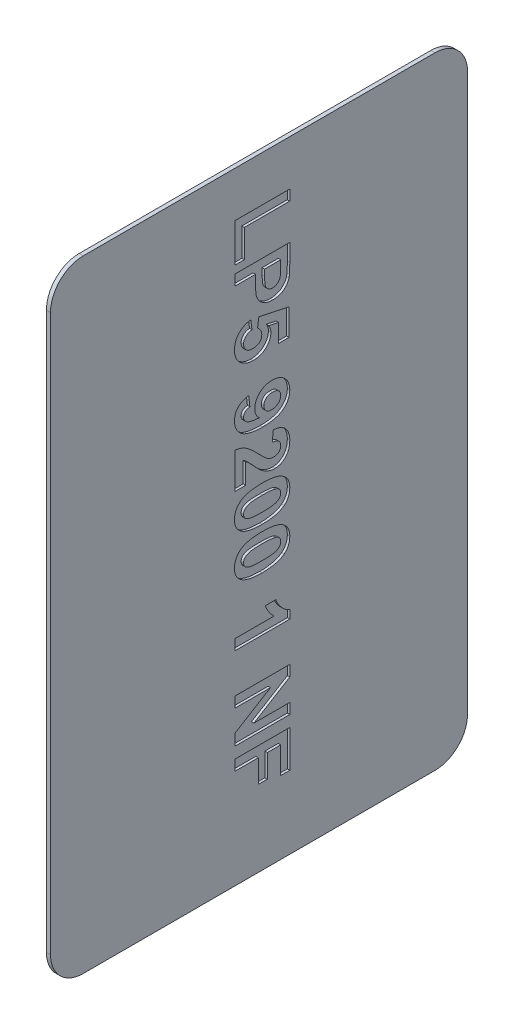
SolidWorks part; units mm, degrees
ref_plane "Plan de face" through (0, 0, 0) normal (0, 0, 1) x (1, 0, 0)
ref_plane "Plan de dessus" through (0, 0, 0) normal (0, 1, 0) x (1, 0, 0)
ref_plane "Plan de droite" through (0, 0, 0) normal (1, 0, 0) x (0, 0, -1)
ref_plane "Plan1" through (0.5, 0, 0) normal (1, 0, 0) x (0, 0, -1)
sketch "Esquisse1" plane through (0.5, 0, 0) normal (1, 0, 0) x (0, 0, -1)
  line L0 (25.5, -34) -> (25.5, 34)
  line L1 (21.5, 38) -> (-21.5, 38)
  line L2 (-25.5, 34) -> (-25.5, -34)
  line L3 (-21.5, -38) -> (21.5, -38)
  arc A0 (25.5, 34) -> (21.5, 38) centre (21.5, 34) ccw
  arc A1 (-21.5, 38) -> (-25.5, 34) centre (-21.5, 34) ccw
  arc A2 (-25.5, -34) -> (-21.5, -38) centre (-21.5, -34) ccw
  arc A3 (21.5, -38) -> (25.5, -34) centre (21.5, -34) ccw
extrude "Boss.-Extru.1" add sketch "Esquisse1" against normal blind 0.5
sketch "Esquisse3" plane through (0.5, 0, 0) normal (1, 0, 0) x (0, 0, -1)
  line L0 (-2.9196, 33.1328) -> (-2.9196, -29.3826)
sketch "Esquisse4" plane through (0.5, 0, 0) normal (1, 0, 0) x (0, 0, -1)
  text T0 "LP5 9200 1 NF" font "Arial" height in points 26
extrude "Enlèv. mat.-Extru.3" cut sketch "Esquisse4" against normal blind 0.3
